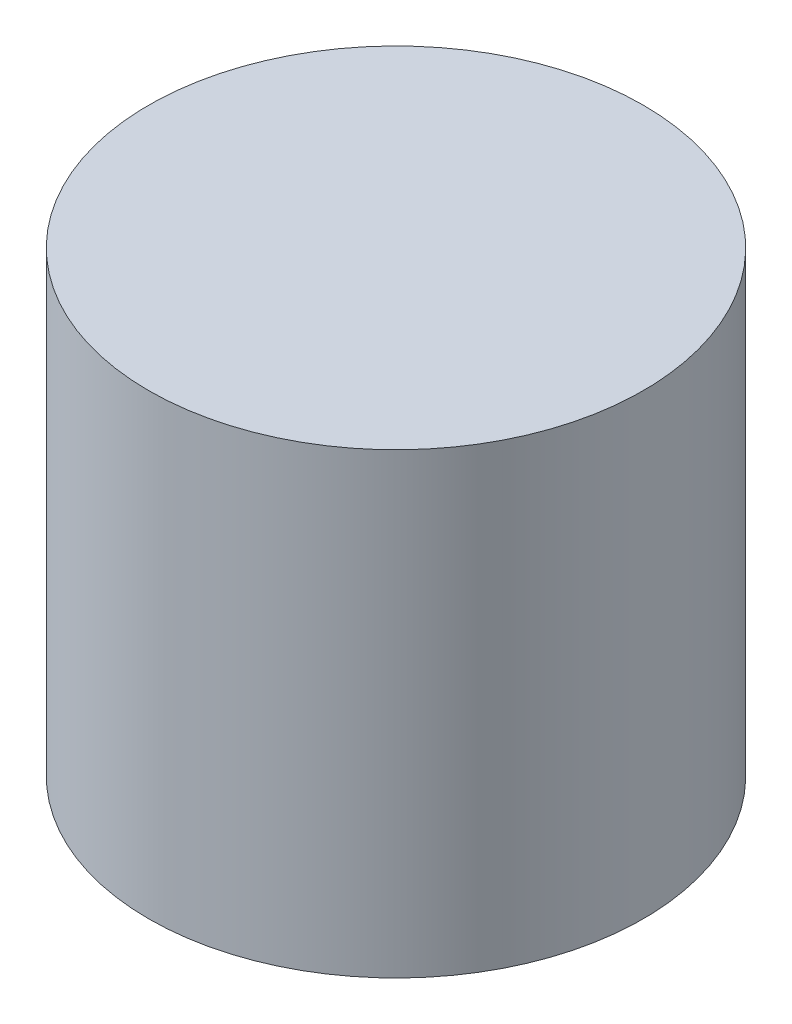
SolidWorks part; units mm, degrees
ref_plane "Front Plane" through (0, 0, 0) normal (0, 0, 1) x (1, 0, 0)
ref_plane "Top Plane" through (0, 0, 0) normal (0, 1, 0) x (1, 0, 0)
ref_plane "Right Plane" through (0, 0, 0) normal (1, 0, 0) x (0, 0, -1)
sketch "Sketch1" plane through (0, 0, 0) normal (0, 1, 0) x (1, 0, 0)
  circle A0 centre (0, 0) radius 10
  dimension "D1" = 20
extrude "Boss-Extrude1" add sketch "Sketch1" along normal blind 18.5
